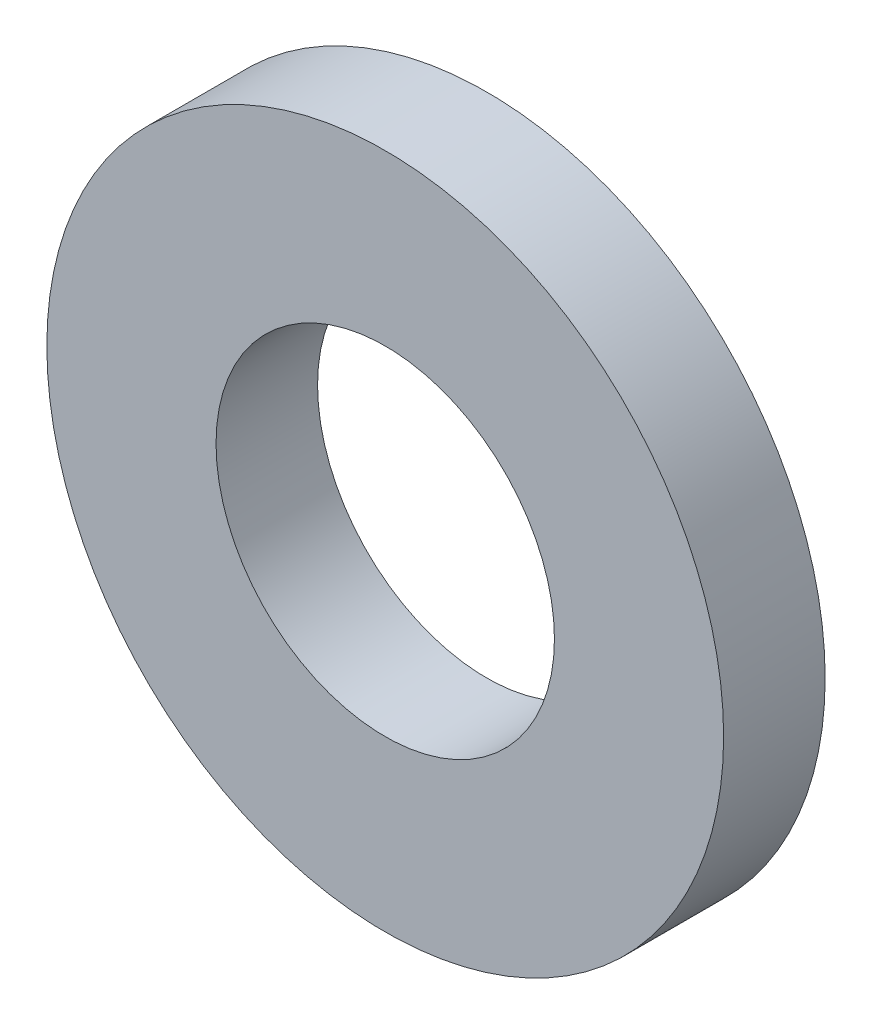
SolidWorks part; units mm, degrees
ref_plane "Front" through (0, 0, 0) normal (0, 0, 1) x (1, 0, 0)
ref_plane "Top" through (0, 0, 0) normal (0, 1, 0) x (1, 0, 0)
ref_plane "Right" through (0, 0, 0) normal (1, 0, 0) x (0, 0, -1)
sketch "Esquisse1" plane through (0, 0, 0) normal (0, 0, 1) x (1, 0, 0)
  circle A0 centre (0, 0) radius 5
  circle A1 centre (0, 0) radius 2.5
  dimension "D1" = 10
  dimension "D2" = 5
extrude "Boss.-Extru.1" add sketch "Esquisse1" along normal blind 1.5
sketch "Esquisse2" plane through (0, 0, 1.5) normal (0, 0, 1) x (1, 0, 0)
  point P0 (0, 0)
sketch "Esquisse3" plane through (0, 0, 0) normal (0, 0, -1) x (-1, 0, 0)
  point P0 (0, 0)
